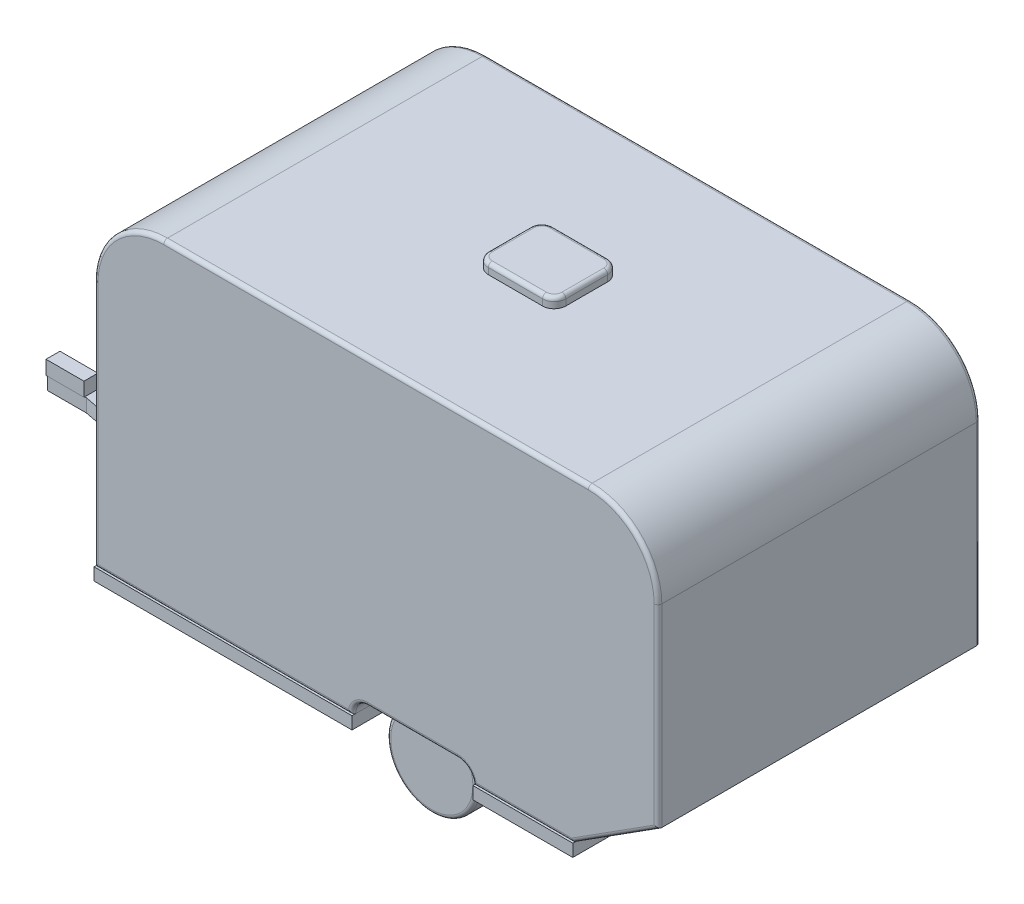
SolidWorks part; units mm, degrees
ref_plane "Plan de face" through (0, 0, 0) normal (0, 0, 1) x (1, 0, 0)
ref_plane "Plan de dessus" through (0, 0, 0) normal (0, 1, 0) x (1, 0, 0)
ref_plane "Plan de droite" through (0, 0, 0) normal (1, 0, 0) x (0, 0, -1)
sketch "Esquisse1" plane through (0, 0, 0) normal (0, 1, 0) x (1, 0, 0)
  line L1 (0, 0) -> (3090, 0)
  line L2 (0, 0) -> (0, 2080)
  line L3 (0, 2080) -> (3090, 2080)
  line L4 (3090, 0) -> (3090, 2080)
  line L5 (40, 2040) -> (3050, 2040)
  line L6 (40, 2040) -> (40, 40)
  line L7 (40, 40) -> (3050, 40)
  line L8 (3050, 2040) -> (3050, 40)
  dimension "D1" = 2080
  dimension "D2" = 3090
  dimension "D3" = 40
  dimension "D4" = 40
  dimension "D5" = 40
  dimension "D6" = 40
extrude "Boss.-Extru.1" add sketch "Esquisse1" along normal blind 80
sketch "Esquisse2" plane through (0, 0, 0) normal (0, 1, 0) x (1, 0, 0)
  line L0 (40, 2040) -> (40, 40) construction
  line L1 (40, 1665) -> (3050, 1665)
  line L2 (40, 1665) -> (40, 1705)
  line L3 (40, 1705) -> (3050, 1705)
  line L4 (3050, 1665) -> (3050, 1705)
  line L5 (3050, 40) -> (3050, 2040) construction
  line L6 (3050, 2040) -> (40, 2040) construction
  line L7 (40, 415) -> (3050, 415)
  line L8 (40, 415) -> (40, 375)
  line L9 (40, 375) -> (3050, 375)
  line L10 (3050, 415) -> (3050, 375)
  line L11 (1665, 2040) -> (1625, 2040)
  line L12 (1665, 2040) -> (1665, 1705)
  line L13 (1665, 1705) -> (1625, 1705)
  line L14 (1625, 2040) -> (1625, 1705)
  line L15 (40, 40) -> (3050, 40) construction
  line L16 (2445, 2040) -> (2485, 2040)
  line L17 (2445, 2040) -> (2445, 1705)
  line L18 (2445, 1705) -> (2485, 1705)
  line L19 (2485, 2040) -> (2485, 1705)
  line L20 (1625, 375) -> (1665, 375)
  line L21 (1625, 375) -> (1625, 40)
  line L22 (1625, 40) -> (1665, 40)
  line L23 (1665, 375) -> (1665, 40)
  line L25 (2445, 375) -> (2485, 375)
  line L26 (2445, 375) -> (2445, 40)
  line L27 (2445, 40) -> (2485, 40)
  line L28 (2485, 375) -> (2485, 40)
  dimension "D1" = 40
  dimension "D2" = 40
  dimension "D3" = 565
  dimension "D4" = 780
  dimension "D5" = 40
  dimension "D6" = 335
  dimension "D7" = 335
  dimension "D8" = 40
extrude "Boss.-Extru.7" add sketch "Esquisse2" along normal blind 80 contours L1 L4 L3 L2 | L12 L13 L14 L11 | L19 L18 L17 L16 | L23 L22 L21 L20 | L9 L10 L7 L8 | L26 L27 L28 L25
sketch "Esquisse4" plane through (0, 0, 0) normal (0, 1, 0) x (1, 0, 0)
  line L0 (40, 1050) -> (585, 1050)
  line L1 (40, 1665) -> (40, 415) construction
  line L2 (585, 1050) -> (585, 1665)
  line L3 (40, 1665) -> (3050, 1665) construction
  line L4 (585, 1665) -> (615, 1665)
  line L5 (615, 1665) -> (615, 1050)
  line L6 (615, 1050) -> (1185, 1050)
  line L7 (1185, 1050) -> (1185, 1665)
  line L8 (1185, 1665) -> (1215, 1665)
  line L9 (1215, 1665) -> (1215, 1050)
  line L10 (1215, 1050) -> (2745, 1050)
  line L11 (2745, 1050) -> (2745, 1665)
  line L12 (2745, 1665) -> (2775, 1665)
  line L13 (2775, 1665) -> (2775, 1432.5)
  line L14 (2775, 1432.5) -> (3050, 1432.5)
  line L15 (3050, 415) -> (3050, 1665) construction
  line L16 (3050, 1432.5) -> (3050, 1412.5)
  line L17 (3050, 1412.5) -> (2775, 1412.5)
  line L18 (2775, 1412.5) -> (2775, 667.5)
  line L20 (40, 1030) -> (40, 1050)
  line L21 (-422.2595, 1040) -> (3457.475, 1040) construction
  line L22 (2775, 415) -> (2775, 647.5)
  line L23 (2745, 415) -> (2775, 415)
  line L24 (2745, 1030) -> (2745, 415)
  line L25 (1215, 1030) -> (2745, 1030)
  line L26 (1215, 415) -> (1215, 1030)
  line L27 (1185, 415) -> (1215, 415)
  line L28 (1185, 1030) -> (1185, 415)
  line L29 (615, 1030) -> (1185, 1030)
  line L30 (615, 415) -> (615, 1030)
  line L31 (585, 415) -> (615, 415)
  line L32 (585, 1030) -> (585, 415)
  line L33 (40, 1030) -> (585, 1030)
  line L34 (3050, 647.5) -> (3050, 667.5)
  line L35 (3050, 667.5) -> (2775, 667.5)
  line L36 (2775, 647.5) -> (3050, 647.5)
  dimension "D2" = 30
  dimension "D3" = 30
  dimension "D4" = 30
  dimension "D5" = 20
  dimension "D6" = 275
  dimension "D7" = 665
  dimension "D8" = 545
  dimension "D9" = 570
  dimension "D10" = 745
  dimension "D11" = 615
extrude "Boss.-Extru.8" add sketch "Esquisse4" along normal blind 60 from offset 20
sketch "Esquisse5" plane through (0, 0, 0) normal (0, 1, 0) x (1, 0, 0)
  line L1 (2445, 2040) -> (1665, 2040)
  line L2 (2445, 2040) -> (2445, 2090)
  line L3 (2445, 2090) -> (1665, 2090)
  line L4 (1665, 2040) -> (1665, 2090)
  line L5 (1665, 40) -> (2445, 40)
  line L6 (1665, 40) -> (1665, -10)
  line L7 (1665, -10) -> (2445, -10)
  line L8 (2445, 40) -> (2445, -10)
  dimension "D1" = 780
  dimension "D2" = 780
  dimension "D3" = 50
  dimension "D4" = 50
extrude "Enlèv. mat.-Extru.5" cut sketch "Esquisse5" along normal through all
sketch "Esquisse6" plane through (0, 0, 0) normal (0, 1, 0) x (1, 0, 0)
  line L0 (1665, 1705) -> (2445, 1705) construction
  line L1 (2007.5, 1705) -> (2102.5, 1705)
  line L2 (2007.5, 1705) -> (2007.5, 375)
  line L3 (2007.5, 375) -> (2102.5, 375)
  line L4 (2102.5, 1705) -> (2102.5, 375)
  line L5 (1665, 375) -> (2445, 375) construction
  dimension "D1" = 95
  dimension "D2" = 342.5
extrude "Boss.-Extru.9" add sketch "Esquisse6" against normal blind 95
fillet "Congé1" radius 10 4 edges at (2007.5, -95, -1040) (2102.5, -95, -1040) (2102.5, 0, -1040) (2007.5, 0, -1040)
sketch "Esquisse8" plane through (0, 0, -375) normal (0, 0, 1) x (1, 0, 0)
  line L0 (2017.5, -95) -> (2092.5, -95) construction
  circle A0 centre (2055, -47.5) radius 35
  dimension "D3" = 70
  dimension "D1" = 47.5
  dimension "D2" = 47.5
extrude "Boss.-Extru.10" add sketch "Esquisse8" along normal blind 95 and the other way blind 1422
sketch "Esquisse9" plane through (0, 0, -280) normal (0, 0, 1) x (1, 0, 0)
  circle A0 centre (2055, -47.5) radius 290
  dimension "D1" = 580
extrude "Boss.-Extru.11" add sketch "Esquisse9" along normal blind 155
sketch "Esquisse10" plane through (0, 0, -1797) normal (0, 0, -1) x (-1, 0, 0)
  circle A0 centre (-2055, -47.5) radius 290
  dimension "D1" = 580
extrude "Boss.-Extru.12" add sketch "Esquisse10" along normal blind 155
fillet "Congé2" radius 25 4 edges at (2345, -47.5, -125) (2345, -47.5, -280) (1765, -47.5, -1797) (1765, -47.5, -1952)
sketch "Esquisse11" plane through (0, 0, 0) normal (0, -1, 0) x (1, 0, 0)
  line L0 (-1300, -1080) -> (-1050, -1080)
  line L2 (-1300, -1000) -> (-1050, -1000)
  line L3 (-1300, -1000) -> (-1300, -1080)
  line L4 (-1050, -1000) -> (2007.5, -415)
  line L5 (2007.5, -415) -> (2007.5, -460)
  line L6 (2007.5, -460) -> (-1021.2543, -1039.5)
  line L7 (-1021.2543, -1039.5) -> (-1021.2543, -1040.5)
  line L8 (-1021.2543, -1040.5) -> (2007.5, -1620)
  line L9 (2007.5, -1705) -> (2007.5, -375) construction
  line L10 (2007.5, -1620) -> (2007.5, -1665)
  line L11 (2007.5, -1665) -> (-1050, -1080)
  line L12 (0, -2080) -> (0, 0) construction
  dimension "D1" = 1300
  dimension "D2" = 80
  dimension "D3" = 250
  dimension "D4" = 45
  dimension "D5" = 45
  dimension "D6" = 1
  dimension "D7" = 1000
  dimension "D8" = 250
extrude "Boss.-Extru.26" add sketch "Esquisse11" along normal blind 85 separate body
sketch "Esquisse12" plane through (0, 0, 0) normal (0, 1, 0) x (1, 0, 0)
  line L1 (-1305, 1085) -> (-1060, 1085)
  line L2 (-1305, 1085) -> (-1305, 995)
  line L3 (-1305, 995) -> (-1060, 995)
  line L4 (-1060, 1085) -> (-1060, 995)
  dimension "D1" = 90
  dimension "D2" = 5
  dimension "D3" = 5
  dimension "D4" = 245
extrude "Boss.-Extru.27" add sketch "Esquisse12" along normal blind 90
sketch "Esquisse14" plane through (0, 0, -2080) normal (0, 0, -1) x (-1, 0, 0)
  line L0 (0, 80) -> (0, 1680)
  line L1 (-450, 2130) -> (-3190, 2130)
  line L2 (-3640, 1680) -> (-3640, 430)
  line L3 (-3640, 430) -> (-3090, 80)
  line L4 (-3090, 80) -> (-2445, 80)
  line L5 (-2345, 180) -> (-1765, 180)
  line L6 (-1665, 80) -> (0, 80)
  arc A0 (0, 1680) -> (-450, 2130) centre (-450, 1680) ccw
  arc A1 (-3190, 2130) -> (-3640, 1680) centre (-3190, 1680) ccw
  arc A2 (-2445, 80) -> (-2345, 180) centre (-2345, 80) cw
  arc A3 (-1765, 180) -> (-1665, 80) centre (-1765, 80) cw
  dimension "D1" = 2050
  dimension "D2" = 100
  dimension "D3" = 100
  dimension "D4" = 350
  dimension "D5" = 550
  dimension "D6" = 450
  dimension "D7" = 450
extrude "Boss.-Extru.28" add sketch "Esquisse14" against normal blind 2080 separate body
sketch "Esquisse15" plane through (0, 2130, 0) normal (0, 1, 0) x (1, 0, 0)
  line L0 (450, 2080) -> (3190, 2080) construction
  line L1 (1715, 1250) -> (2065, 1250)
  line L2 (1640, 1175) -> (1640, 905)
  line L3 (1715, 830) -> (2065, 830)
  line L4 (2140, 1175) -> (2140, 905)
  line L6 (3640, 0) -> (3640, 2080) construction
  arc A0 (1640, 905) -> (1715, 830) centre (1715, 905) ccw
  arc A1 (2065, 830) -> (2140, 905) centre (2065, 905) ccw
  arc A2 (2065, 1250) -> (2140, 1175) centre (2065, 1175) cw
  arc A3 (1715, 1250) -> (1640, 1175) centre (1715, 1175) ccw
  dimension "D1" = 75
  dimension "D2" = 500
  dimension "D3" = 420
  dimension "D4" = 830
  dimension "D5" = 1500
extrude "Boss.-Extru.29" add sketch "Esquisse15" along normal blind 65 from offset 25 separate body
fillet "Congé3" radius 25 8 edges at (1640, 2220, -1040) (1661.967, 2220, -1228.033) (1890, 2220, -1250) (2118.033, 2220, -1228.033) (2140, 2220, -1040) (2118.033, 2220, -851.967) (1890, 2220, -830) (1661.967, 2220, -851.967)
fillet "Congé4" radius 25 22 edges at (1694.2893, 150.7107, -2080) (2055, 180, -2080) (2415.7107, 150.7107, -2080) (2767.5, 80, -2080) (3365, 255, -2080) (3640, 1055, -2080) (3508.1981, 1998.1981, -2080) (1820, 2130, -2080) (131.8019, 1998.1981, -2080) (0, 880, -2080) (832.5, 80, -2080) (0, 880, 0) (131.8019, 1998.1981, 0) (1820, 2130, 0) (3508.1981, 1998.1981, 0) (3640, 1055, 0) (3365, 255, 0) (2767.5, 80, 0) (2415.7107, 150.7107, 0) (2055, 180, 0) (1694.2893, 150.7107, 0) (832.5, 80, 0)
sketch "Esquisse16" plane through (0, 0, -2080) normal (0, 0, -1) x (-1, 0, 0)
  line L0 (-1642.5255, 105) -> (-25, 105) construction
  line L1 (-1215, 105) -> (-665, 105)
  line L2 (-1215, 105) -> (-1215, 1730)
  line L3 (-1040, 1905) -> (-840, 1905)
  line L4 (-665, 105) -> (-665, 1730)
  line L5 (-3615, 1680) -> (-3615, 443.7236) construction
  line L6 (-3335, 1610) -> (-2585, 1610)
  line L7 (-3410, 1535) -> (-3410, 1035)
  line L8 (-3335, 960) -> (-2585, 960)
  line L9 (-2510, 1535) -> (-2510, 1035)
  line L10 (-3082.72, 105) -> (-2467.4745, 105) construction
  arc A0 (-3410, 1035) -> (-3335, 960) centre (-3335, 1035) ccw
  arc A1 (-2585, 960) -> (-2510, 1035) centre (-2585, 1035) ccw
  arc A2 (-2585, 1610) -> (-2510, 1535) centre (-2585, 1535) cw
  arc A3 (-3335, 1610) -> (-3410, 1535) centre (-3335, 1535) ccw
  arc A4 (-840, 1905) -> (-665, 1730) centre (-840, 1730) cw
  arc A5 (-1215, 1730) -> (-1040, 1905) centre (-1040, 1730) cw
  point P18 (-2510, 960)
  point P21 (-2510, 1610)
  point P24 (-3410, 1610)
  point P27 (-665, 1905)
  point P30 (-1215, 1905)
  dimension "D7" = 75
  dimension "D8" = 175
  dimension "D1" = 550
  dimension "D2" = 1800
  dimension "D3" = 900
  dimension "D4" = 650
  dimension "D5" = 205
  dimension "D6" = 855
  dimension "D9" = 450
extrude "Boss.-Extru.30" add sketch "Esquisse16" along normal blind 30
fillet "Congé5" radius 25 14 edges at (1163.7437, 1853.7437, -2110) (940, 1905, -2110) (716.2563, 1853.7437, -2110) (665, 917.5, -2110) (940, 105, -2110) (1215, 917.5, -2110) (3410, 1285, -2110) (3388.033, 1588.033, -2110) (2960, 1610, -2110) (2531.967, 1588.033, -2110) (2510, 1285, -2110) (2531.967, 981.967, -2110) (2960, 960, -2110) (3388.033, 981.967, -2110)
sketch "Esquisse17" plane through (0, 0, 0) normal (-1, 0, 0) x (0, 0, 1)
  line L0 (-25, 1680) -> (-2055, 1680) construction
  line L1 (-1867, 1660) -> (-217, 1660)
  line L2 (-1942, 1585) -> (-1942, 1035)
  line L3 (-1867, 960) -> (-217, 960)
  line L4 (-142, 1585) -> (-142, 1035)
  line L6 (0, 1680) -> (0, 2105) construction
  arc A0 (-1942, 1035) -> (-1867, 960) centre (-1867, 1035) ccw
  arc A1 (-217, 960) -> (-142, 1035) centre (-217, 1035) ccw
  arc A2 (-217, 1660) -> (-142, 1585) centre (-217, 1585) cw
  arc A3 (-1867, 1660) -> (-1942, 1585) centre (-1867, 1585) ccw
  point P10 (-142, 960)
  point P13 (-142, 1660)
  point P16 (-1942, 1660)
  dimension "D4" = 75
  dimension "D1" = 1800
  dimension "D2" = 700
  dimension "D3" = 20
  dimension "D5" = 142
extrude "Boss.-Extru.31" add sketch "Esquisse17" along normal blind 30
fillet "Congé6" radius 25 8 edges at (-30, 1310, -1942) (-30, 1638.033, -1920.033) (-30, 1660, -1042) (-30, 1638.033, -163.967) (-30, 1310, -142) (-30, 981.967, -163.967) (-30, 960, -1042) (-30, 981.967, -1920.033)
sketch "Esquisse18" plane through (0, 0, -2110) normal (0, 0, -1) x (-1, 0, 0)
  line L0 (-1215, 1730) -> (-1215, 105) construction
  line L1 (-1190, 130) -> (-690, 130) construction
  circle A0 centre (-1115, 1080) radius 42.5
  dimension "D1" = 85
  dimension "D2" = 100
  dimension "D3" = 950
extrude "Enlèv. mat.-Extru.6" cut sketch "Esquisse18" against normal blind 15
sketch "Esquisse19" plane through (0, 0, -2080) normal (0, 0, -1) x (-1, 0, 0)
  line L0 (-3615, 917.5) -> (-1215, 917.5)
  line L1 (-3615, 1680) -> (-3615, 443.7236) construction
  line L2 (-1215, 1730) -> (-1215, 105) construction
  line L3 (-1215, 917.5) -> (-1215, 792.5)
  line L4 (-1215, 792.5) -> (-3615, 792.5)
  line L5 (-3615, 792.5) -> (-3615, 917.5)
  line L6 (-665, 792.5) -> (-25, 792.5)
  line L7 (-665, 105) -> (-665, 1730) construction
  line L8 (-25, 105) -> (-25, 1680) construction
  line L9 (-25, 792.5) -> (-25, 917.5)
  line L10 (-25, 917.5) -> (-665, 917.5)
  line L11 (-665, 917.5) -> (-665, 792.5)
  line L12 (-665, 757.5) -> (-25, 757.5)
  line L13 (-665, 1730) -> (-665, 105) construction
  line L14 (-25, 757.5) -> (-25, 717.5)
  line L15 (-25, 717.5) -> (-665, 717.5)
  line L16 (-665, 717.5) -> (-665, 757.5)
  line L17 (-1215, 717.5) -> (-3615, 717.5)
  line L18 (-3615, 717.5) -> (-3615, 757.5)
  line L19 (-3615, 757.5) -> (-1215, 757.5)
  line L20 (-1215, 757.5) -> (-1215, 717.5)
  dimension "D1" = 125
  dimension "D2" = 125
  dimension "D3" = 35
  dimension "D4" = 40
extrude "Enlèv. mat.-Extru.7" cut sketch "Esquisse19" against normal blind 10
sketch "Esquisse20" plane through (0, 0, 0) normal (-1, 0, 0) x (0, 0, 1)
  line L0 (-2055, 910) -> (-25, 910)
  line L1 (-2055, 1680) -> (-2055, 80) construction
  line L2 (-25, 80) -> (-25, 1680) construction
  line L3 (-25, 910) -> (-25, 785)
  line L4 (-25, 785) -> (-2055, 785)
  line L5 (-2055, 785) -> (-2055, 910)
  line L6 (-2055, 755) -> (-25, 755)
  line L7 (-25, 755) -> (-25, 715)
  line L8 (-25, 715) -> (-2055, 715)
  line L9 (-2055, 715) -> (-2055, 755)
  dimension "D1" = 125
  dimension "D2" = 30
  dimension "D3" = 40
  dimension "D4" = 830
extrude "Enlèv. mat.-Extru.8" cut sketch "Esquisse20" against normal blind 10
sketch "Esquisse21" plane through (0, 0, -2080) normal (0, 0, -1) x (-1, 0, 0)
  line L0 (0, 0) -> (420, 0)
  line L1 (1050, 0) -> (-2007.5, 0) construction
  line L2 (420, 0) -> (420, 420)
  line L3 (407.8447, 460.9334) -> (298.9671, 628.0923)
  line L4 (247.7115, 661.2581) -> (0, 700)
  line L5 (0, 715) -> (0, 80) construction
  line L6 (0, 700) -> (0, 0)
  arc A0 (420, 420) -> (407.8447, 460.9334) centre (345, 420) ccw
  arc A1 (298.9671, 628.0923) -> (247.7115, 661.2581) centre (236.1224, 587.1589) ccw
  dimension "D1" = 75
  dimension "D2" = 700
  dimension "D3" = 420
  dimension "D4" = 420
  dimension "D5" = 247.7115
  dimension "D6" = 587.1589
extrude "Boss.-Extru.33" add sketch "Esquisse21" against normal blind 1080 from offset 500 separate body
fillet "Congé7" radius 50 10 edges at (-416.897, 441.35, -500) (-420, 210, -500) (-353.4059, 544.5128, -500) (-276.8666, 650.1264, -500) (-123.8557, 680.629, -500) (-420, 210, -1580) (-416.897, 441.35, -1580) (-353.4059, 544.5128, -1580) (-276.8666, 650.1264, -1580) (-123.8557, 680.629, -1580)
